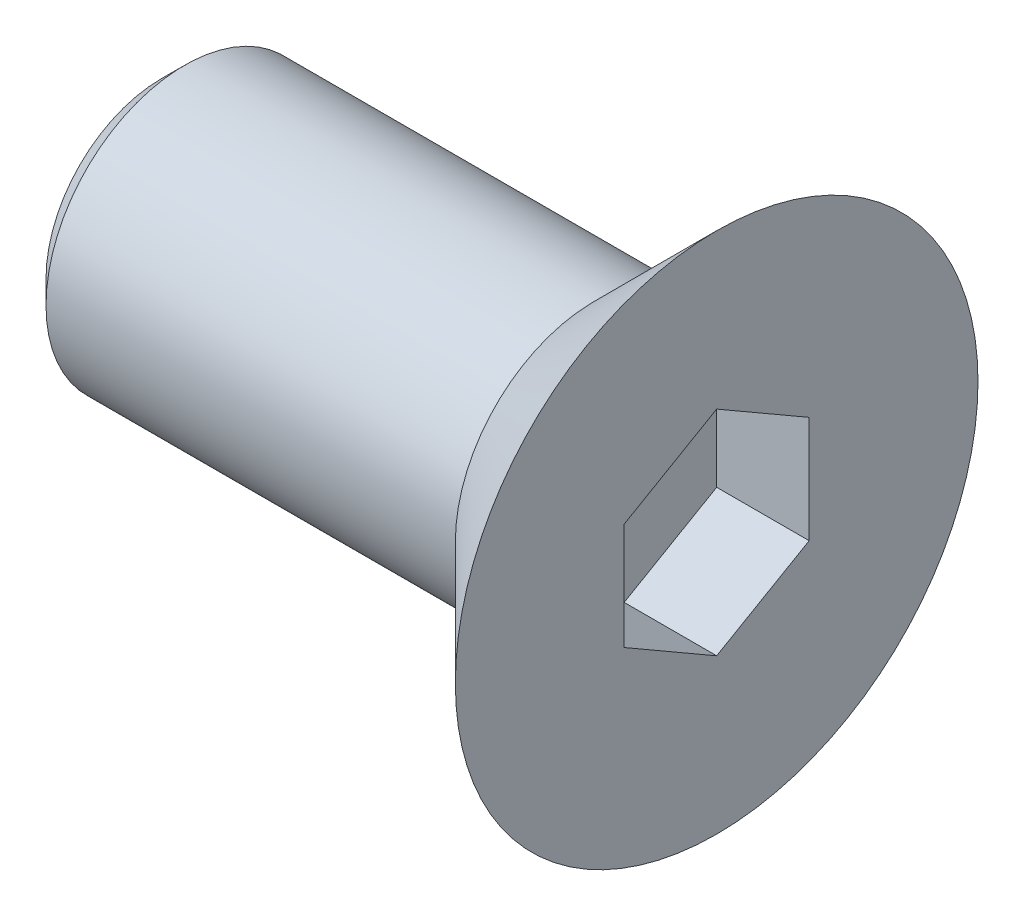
SolidWorks part; units mm, degrees
ref_plane "Face" through (0, 0, 0) normal (0, 0, 1) x (1, 0, 0)
ref_plane "Dessus" through (0, 0, 0) normal (0, 1, 0) x (1, 0, 0)
ref_plane "Droite" through (0, 0, 0) normal (1, 0, 0) x (0, 0, -1)
sketch "Esquisse1" plane through (0, 0, 0) normal (0, 0, 1) x (1, 0, 0)
  line L0 (-18.7903, 0) -> (25.3923, 0) construction
  line L1 (-2.7459, 0) -> (-2.7459, 5.65)
  line L2 (-2.7459, 5.65) -> (-5.3959, 3)
  line L3 (-5.3959, 3) -> (-14.7459, 3)
  line L4 (-14.7459, 3) -> (-14.7459, 0)
  line L5 (-14.7459, 0) -> (-2.7459, 0)
  dimension "D1" = 6
  dimension "D2" = 11.3
  dimension "D3" = 45
  dimension "D4" = 12
revolve "Révolution1" add sketch "Esquisse1" angle 360 about L0
chamfer "Chanfrein1" distance 0.5 angle 45 1 edges at (-14.7459, 0, 3)
sketch "Esquisse2" plane through (-2.7459, 0, 0) normal (1, 0, 0) x (0, 0, -1)
  line L1 (2, -1.1547) -> (2, 1.1547)
  line L2 (2, 1.1547) -> (0, 2.3094)
  line L3 (0, 2.3094) -> (-2, 1.1547)
  line L4 (-2, 1.1547) -> (-2, -1.1547)
  line L5 (-2, -1.1547) -> (0, -2.3094)
  line L6 (0, -2.3094) -> (2, -1.1547)
  circle A0 centre (0, 0) radius 2 construction
  dimension "D1" = 4
extrude "Enlèv. mat.-Extru.1" cut sketch "Esquisse2" against normal blind 2
